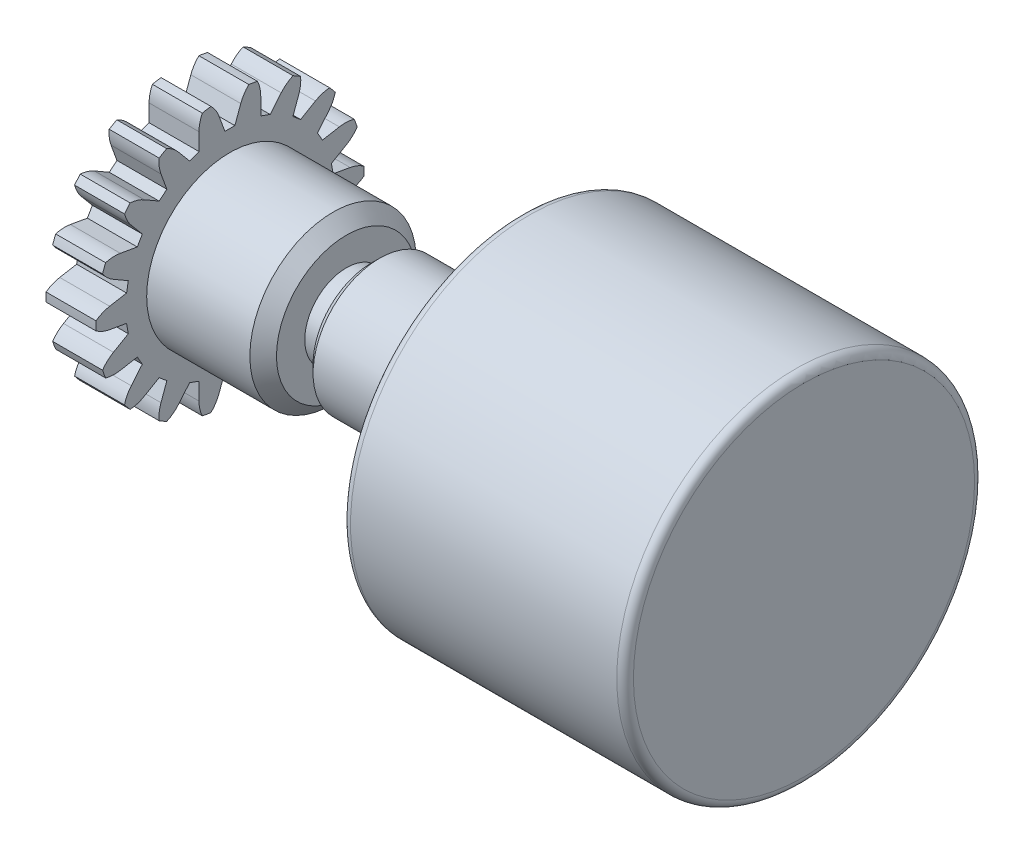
SolidWorks part; units mm, degrees
ref_plane "Plan de face" through (0, 0, 0) normal (0, 0, 1) x (1, 0, 0)
ref_plane "Plan de dessus" through (0, 0, 0) normal (0, 1, 0) x (1, 0, 0)
ref_plane "Plan de droite" through (0, 0, 0) normal (1, 0, 0) x (0, 0, -1)
sketch "Esquisse1" plane through (0, 0, 0) normal (0, 0, 1) x (1, 0, 0)
  line L0 (-19.4483, 0) -> (45.9971, 0) construction
  line L3 (0, 0) -> (0, 8.05)
  line L4 (0, 8.05) -> (3, 8.05)
  line L5 (3, 5) -> (3, 8.05)
  line L6 (3, 5) -> (10, 5)
  line L7 (10, 0) -> (0, 0)
  line L9 (10, 5) -> (10, 0)
  dimension "D1" = 5
  dimension "D2" = 3
  dimension "D3" = 7
  dimension "D4" = 8.05
revolve "Révolution1" add sketch "Esquisse1" angle 360 about L0
sketch "Esquisse2" plane through (0, 0, 0) normal (-1, 0, 0) x (0, 0, 1)
  line L0 (0, 17.9781) -> (0, -0.7899) construction
  line L1 (-2.5335, 8.5364) -> (2.5326, 8.5365)
  line L2 (0.6532, 7.2205) -> (0.3, 6.25)
  line L3 (0.3, 6.25) -> (-0.3009, 6.25)
  line L4 (-0.3009, 6.25) -> (-0.6541, 7.2204)
  arc A0 (2.5326, 8.5365) -> (0.6532, 7.2205) centre (2.5326, 6.5365) ccw
  circle A1 centre (0, 0) radius 7.25 construction
  arc A2 (-0.6541, 7.2204) -> (-2.5335, 8.5364) centre (-2.5334, 6.5364) ccw
  dimension "D6" = 14.5
  dimension "D8" = 4
  dimension "D3" = 4
  dimension "D1" = 70
  dimension "D2" = 70
  dimension "D5" = 0.3
extrude "Enlèv. mat.-Extru.1" cut sketch "Esquisse2" against normal through all
pattern_circular "Répétition circulaire1" count 18 over 360 about axis through (0, 0, 0) along (1, 0, 0) of "Enlèv. mat.-Extru.1"
chamfer "Chanfrein1" distance 0.8 angle 45 1 edges at (10, 0, 5)
sketch "Esquisse3" plane through (0, 0, 0) normal (0, 1, 0) x (1, 0, 0)
  line L0 (9.2, 0) -> (3, 0) construction
  circle A0 centre (12, 0) radius 1.5
  dimension "D1" = 3
  dimension "D2" = 12
extrude "Enlèv. mat.-Extru.2" [suppressed] cut sketch "Esquisse3" along normal blind 20
sketch "Esquisse4" plane through (10, 0, 0) normal (1, 0, 0) x (0, 0, -1)
  circle A0 centre (0, 0) radius 2.5
  dimension "D1" = 5
extrude "Boss.-Extru.1" add sketch "Esquisse4" along normal blind 1.5
sketch "Esquisse5" plane through (11.5, 0, 0) normal (1, 0, 0) x (0, 0, -1)
  circle A0 centre (0, 0) radius 4
  dimension "D1" = 8
extrude "Boss.-Extru.2" add sketch "Esquisse5" along normal blind 9
sketch "Esquisse6" plane through (20.5, 0, 0) normal (1, 0, 0) x (0, 0, -1)
  circle A0 centre (0, 0) radius 10.75
  dimension "D1" = 21.5
extrude "Boss.-Extru.3" add sketch "Esquisse6" along normal blind 17
chamfer "Chanfrein2" distance 0.5 angle 45 1 edges at (11.5, 0, -4)
fillet "Congé1" radius 0.5 2 edges at (20.5, 0, -10.75) (37.5, 0, -10.75)
sketch "Esquisse7" plane through (20.5, 0, 0) normal (-1, 0, 0) x (0, 0, 1)
  circle A0 centre (0, 0) radius 4 construction
  circle A1 centre (0, 0) radius 4
extrude "Extru.-Mince1" add sketch "Esquisse7" along normal blind 0.5 separate body thin
